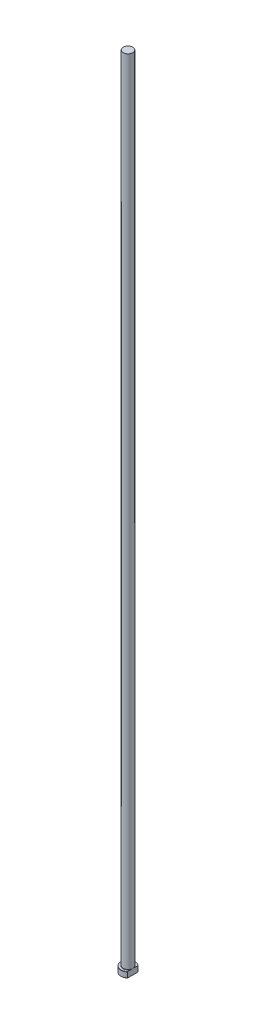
SolidWorks part; units mm, degrees
ref_plane "Front Plane" through (0, 0, 0) normal (0, 0, 1) x (1, 0, 0)
ref_plane "Top Plane" through (0, 0, 0) normal (0, 1, 0) x (1, 0, 0)
ref_plane "Right Plane" through (0, 0, 0) normal (1, 0, 0) x (0, 0, -1)
sketch "Sketch1" plane through (0, 0, 0) normal (0, 0, 1) x (1, 0, 0)
  line L0 (0, 259.9588) -> (0, -15.1925) construction
  line L1 (0, 0) -> (-9, 0)
  line L2 (-9, 0) -> (-9, 7)
  line L3 (-9, 7) -> (-6, 7)
  line L4 (-6, 7) -> (-6, 1000)
  line L5 (-6, 1000) -> (0, 1000)
  line L6 (0, 1000) -> (0, 0)
  dimension "L" = 1000
  dimension "H" = 18
  dimension "T" = 7
  dimension "D" = 12
revolve "Revolve1" add sketch "Sketch1" angle 360 about L0
chamfer "Chamfer1" distance 0.2 angle 45 2 edges at (0, 7, 9) (0, 0, 9)
fillet "Fillet1" radius 0.3 1 edges at (0, 7, 6)
sketch "Sketch2" plane through (0, 0, 0) normal (0, 1, 0) x (1, 0, 0)
  line L0 (6, 6.7082) -> (6, -6.7082)
  circle A0 centre (0, 0) radius 9 construction
  arc A1 (6, -6.7082) -> (6, 6.7082) centre (0, 0) ccw
  circle A2 centre (0, 0) radius 6 construction
extrude "KEY" cut sketch "Sketch2" along normal through all
